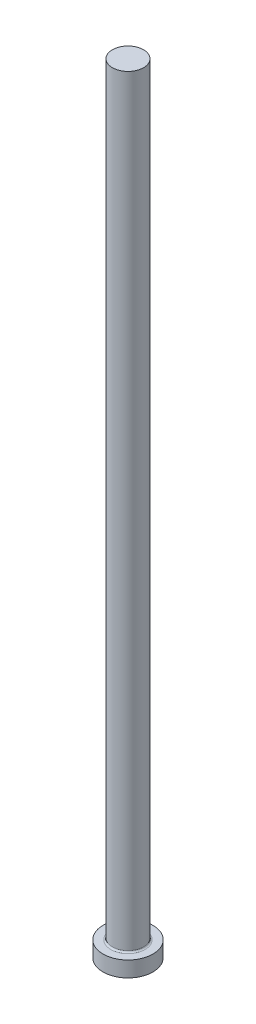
SolidWorks part; units mm, degrees
ref_plane "Plano frontal" through (0, 0, 0) normal (0, 0, 1) x (1, 0, 0)
ref_plane "Plano superior" through (0, 0, 0) normal (0, 1, 0) x (1, 0, 0)
ref_plane "Plano direito" through (0, 0, 0) normal (1, 0, 0) x (0, 0, -1)
sketch "Esboço1" plane through (0, 0, 0) normal (0, 0, 1) x (1, 0, 0)
  line L0 (0, 0) -> (8, 0)
  line L1 (8, 0) -> (8, 5)
  line L2 (8, 5) -> (5.5, 5)
  line L3 (5, 5.5) -> (5, 250)
  line L4 (5, 250) -> (0, 250)
  line L5 (0, 250) -> (0, 0) construction
  line L6 (0, 0) -> (0, 250)
  arc A0 (5.5, 5) -> (5, 5.5) centre (5.5, 5.5) cw
  dimension "D3" = 0.5
  dimension "D1" = 16
  dimension "D2" = 10
  dimension "D4" = 5
  dimension "D5" = 250
revolve "Revolução1" add sketch "Esboço1" angle 360 about L5
sketch "Esboço2"
  dimension "D1" = 0.9
  dimension "D2" = 1.4
  dimension "D3" = 4.3
  dimension "D4" = 0.6
wrap "Envolver1" sketch "Esboço2" wrap type deboss source sketch "Esboço2" thickness 0.1 parameters "D1"=0.1
